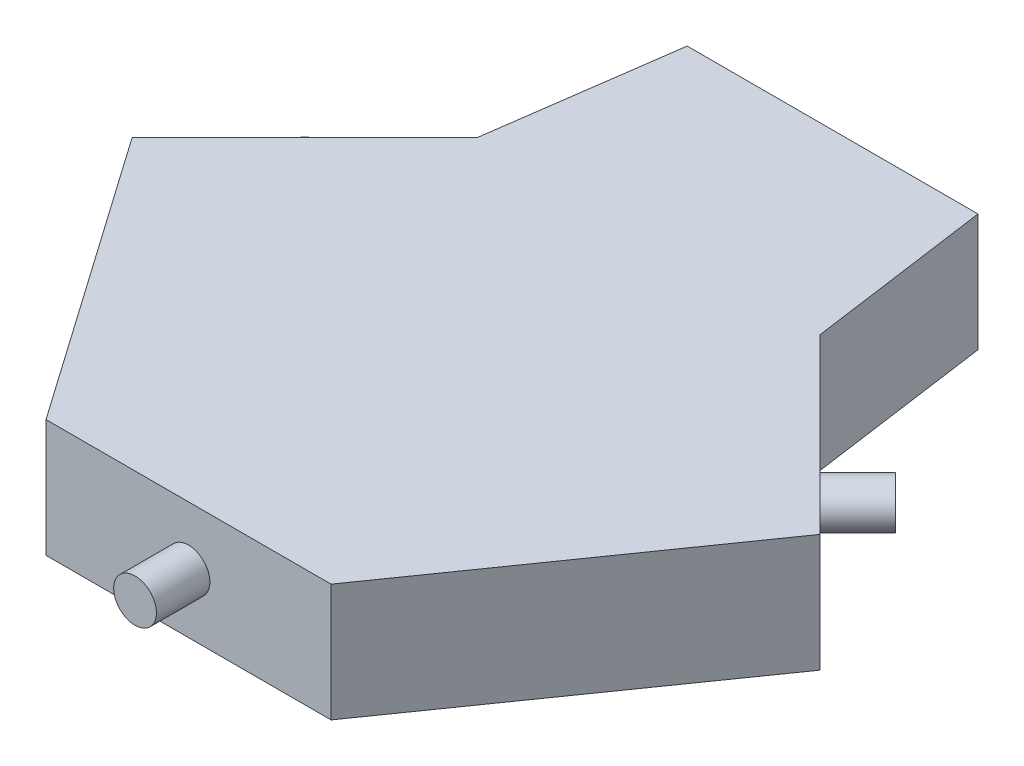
SolidWorks part; units mm, degrees
ref_plane "Front Plane" through (0, 0, 0) normal (0, 0, 1) x (1, 0, 0)
ref_plane "Top Plane" through (0, 0, 0) normal (0, 1, 0) x (1, 0, 0)
ref_plane "Right Plane" through (0, 0, 0) normal (1, 0, 0) x (0, 0, -1)
sketch "Sketch1" plane through (0, 0, 0) normal (0, 1, 0) x (1, 0, 0)
  line L0 (-68, 0) -> (68, 0)
  line L1 (0, 0) -> (0, -86) construction
  line L2 (-80, -86) -> (80, -86)
  line L3 (80, -86) -> (160.7799, -166.7799)
  line L4 (-80, -86) -> (-160.7799, -166.7799)
  line L5 (0, 0) -> (0, -301.2065) construction
  line L6 (-66.6533, -301.2065) -> (66.6533, -301.2065)
  line L7 (160.7799, -166.7799) -> (66.6533, -301.2065)
  line L8 (-66.6533, -301.2065) -> (-160.7799, -166.7799)
  line L9 (68, 0) -> (80, -86)
  line L10 (-68, 0) -> (-80, -86)
  point P4 (0, 0)
  point P11 (0, -86)
  point P17 (0, -301.2065)
  dimension "D1" = 100
  dimension "D2" = 100
extrude "Boss-Extrude1" add sketch "Sketch1" along normal blind 55 contours L8 L6 L7 L3 L2 L4 | L0 L10 L2 L9
sketch "Sketch2" plane through (-3, 0, 3) normal (0.7071, 0, -0.7071) x (-0.7071, 0, -0.7071)
  line L0 (-117.3797, 55) -> (-231.6197, 0) construction
  circle A0 centre (-174.4997, 27.5) radius 10
sketch "Sketch3" plane through (3, 0, 3) normal (-0.7071, 0, -0.7071) x (-0.7071, 0, 0.7071)
  line L0 (231.6197, 0) -> (117.3797, 55) construction
  circle A0 centre (174.4997, 27.5) radius 10
sketch "Sketch4" plane through (0, 0, 301.2065) normal (0, 0, 1) x (1, 0, 0)
  line L0 (66.6533, 55) -> (-66.6533, 0) construction
  circle A0 centre (0, 27.5) radius 10
extrude "Boss-Extrude2" add sketch "Sketch4" along normal blind 25
extrude "Boss-Extrude3" add sketch "Sketch3" along normal blind 25 contours A0
extrude "Boss-Extrude4" add sketch "Sketch2" along normal blind 25 contours A0
